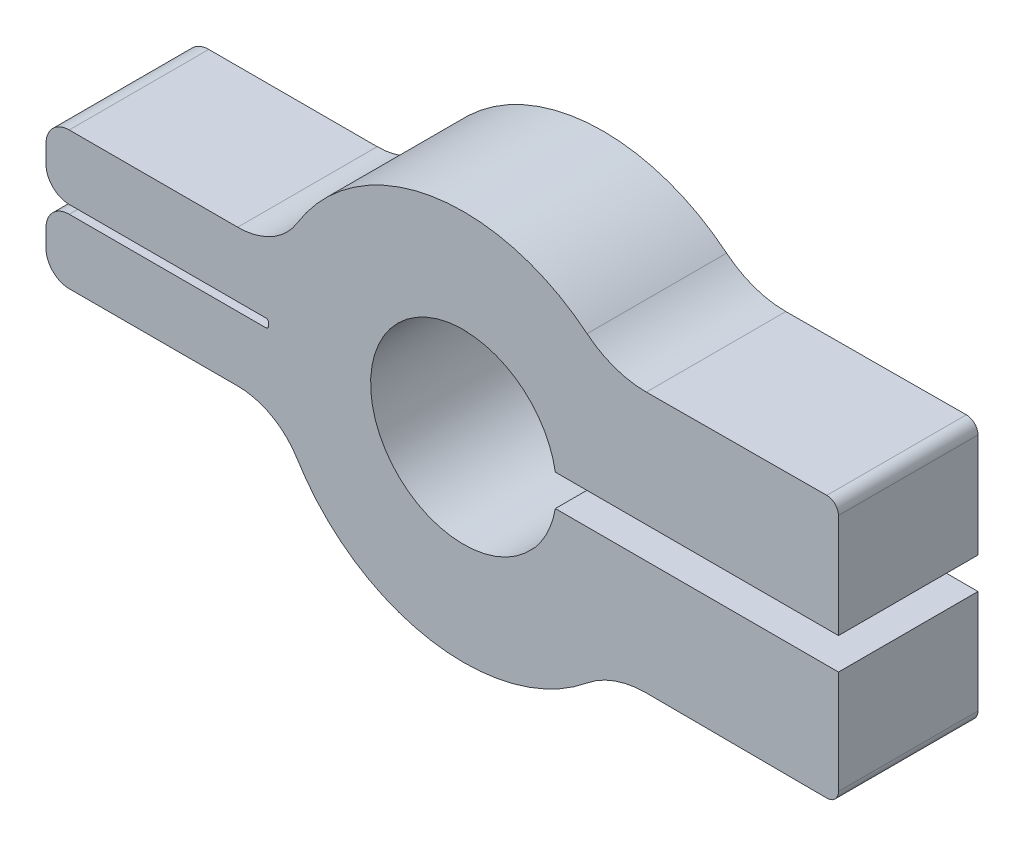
SolidWorks part; units mm, degrees
ref_plane "Front Plane" through (0, 0, 0) normal (0, 0, 1) x (1, 0, 0)
ref_plane "Top Plane" through (0, 0, 0) normal (0, 1, 0) x (1, 0, 0)
ref_plane "Right Plane" through (0, 0, 0) normal (1, 0, 0) x (0, 0, -1)
sketch "Sketch1" plane through (0, 0, 0) normal (0, 0, 1) x (1, 0, 0)
  line L0 (-216.8617, 22.5882) -> (-208.3988, 22.5882)
  line L1 (-192.0439, 28.3737) -> (-184.2825, 28.4094)
  line L2 (-183.7802, 27.9094) -> (-183.7802, 25.6066)
  line L3 (-184.2802, 25.1066) -> (-191.8366, 25.1066)
  line L4 (-191.8366, 20.4342) -> (-184.2802, 20.4342)
  line L5 (-183.7802, 19.9342) -> (-183.7802, 17.6315)
  line L6 (-184.2825, 17.1315) -> (-192.0439, 17.1671)
  line L7 (-191.8366, 25.1066) -> (-196.1779, 25.1066)
  line L8 (-191.8366, 20.4342) -> (-196.1779, 20.4342)
  line L9 (-217.8617, 23.9526) -> (-217.8617, 24.7278)
  line L10 (-216.8617, 25.7278) -> (-209.6182, 25.7278)
  line L11 (-208.2992, 22.7704) -> (-199.9022, 22.7704) construction
  line L12 (-216.8617, 22.9526) -> (-208.3988, 22.9526)
  line L13 (-217.8617, 21.5882) -> (-217.8617, 20.8131)
  line L14 (-216.8617, 19.8131) -> (-209.6182, 19.8131)
  arc A0 (-196.9228, 25.4394) -> (-196.9228, 20.1015) centre (-199.9022, 22.7704) ccw
  arc A1 (-194.5919, 29.2751) -> (-207.0607, 27.1597) centre (-199.9022, 22.7704) ccw
  arc A2 (-208.2988, 22.8517) -> (-208.2988, 22.6892) centre (-199.9022, 22.7704) ccw
  arc A3 (-207.0607, 18.3812) -> (-194.5919, 16.2657) centre (-199.9022, 22.7704) ccw
  arc A4 (-207.0607, 18.3812) -> (-209.6182, 19.8131) centre (-209.6182, 16.8131) ccw
  arc A5 (-207.0607, 27.1597) -> (-209.6182, 25.7278) centre (-209.6182, 28.7278) cw
  arc A6 (-216.8617, 19.8131) -> (-217.8617, 20.8131) centre (-216.8617, 20.8131) cw
  arc A7 (-216.8617, 25.7278) -> (-217.8617, 24.7278) centre (-216.8617, 24.7278) ccw
  arc A8 (-216.8617, 22.5882) -> (-217.8617, 21.5882) centre (-216.8617, 21.5882) ccw
  arc A9 (-216.8617, 22.9526) -> (-217.8617, 23.9526) centre (-216.8617, 23.9526) cw
  arc A10 (-192.0439, 17.1671) -> (-194.5919, 16.2657) centre (-192.0623, 13.1672) ccw
  arc A11 (-192.0439, 28.3737) -> (-194.5919, 29.2751) centre (-192.0623, 32.3737) cw
  arc A12 (-183.7802, 27.9094) -> (-184.2825, 28.4094) centre (-184.2802, 27.9094) ccw
  arc A13 (-183.7802, 25.6066) -> (-184.2802, 25.1066) centre (-184.2802, 25.6066) cw
  arc A14 (-183.7802, 17.6315) -> (-184.2825, 17.1315) centre (-184.2802, 17.6315) cw
  arc A15 (-183.7802, 19.9342) -> (-184.2802, 20.4342) centre (-184.2802, 19.9342) ccw
  arc A16 (-208.2988, 22.6892) -> (-208.3988, 22.5882) centre (-208.3988, 22.6882) cw
  arc A17 (-208.2988, 22.8517) -> (-208.3988, 22.9526) centre (-208.3988, 22.8526) ccw
  arc A18 (-196.1779, 20.4342) -> (-196.9228, 20.1015) centre (-196.1779, 19.4342) ccw
  arc A19 (-196.1779, 25.1066) -> (-196.9228, 25.4394) centre (-196.1779, 26.1066) cw
  point P22 (-207.7612, 19.8131)
  point P25 (-207.7612, 25.7278)
  point P28 (-217.8617, 19.8131)
  point P31 (-217.8617, 25.7278)
  point P34 (-217.8617, 22.5882)
  point P37 (-217.8617, 22.9526)
  point P52 (-208.2972, 22.5882)
  point P55 (-208.2972, 22.9526)
  dimension "D1" = 3
  dimension "D2" = 1
  dimension "D3" = 1
  dimension "D4" = 4
  dimension "D5" = 0.5
  dimension "D6" = 0.1
  dimension "D7" = 1
extrude "Boss-Extrude1" add sketch "Sketch1" along normal blind 6
sketch "Sketch2" plane through (0, 0, 6) normal (0, 0, 1) x (1, 0, 0)
  line L0 (-195.957, 23.4364) -> (-183.7802, 23.4364)
  line L1 (-183.7802, 23.4364) -> (-183.7802, 26.758)
  line L2 (-183.7802, 25.6066) -> (-183.7802, 27.9094) construction
  line L3 (-183.7802, 26.758) -> (-199.8991, 26.758)
  line L4 (-195.8991, 22.758) -> (-184.1781, 22.758) construction
  line L5 (-183.7802, 22.0795) -> (-183.7802, 18.758)
  line L6 (-195.957, 22.0795) -> (-183.7802, 22.0795)
  line L7 (-183.7802, 18.758) -> (-199.8991, 18.758)
  arc A0 (-195.957, 23.4364) -> (-199.8991, 26.758) centre (-199.8991, 22.758) ccw
  arc A1 (-199.8991, 18.758) -> (-195.957, 22.0795) centre (-199.8991, 22.758) ccw
extrude "Boss-Extrude3" add sketch "Sketch2" against normal blind 6
